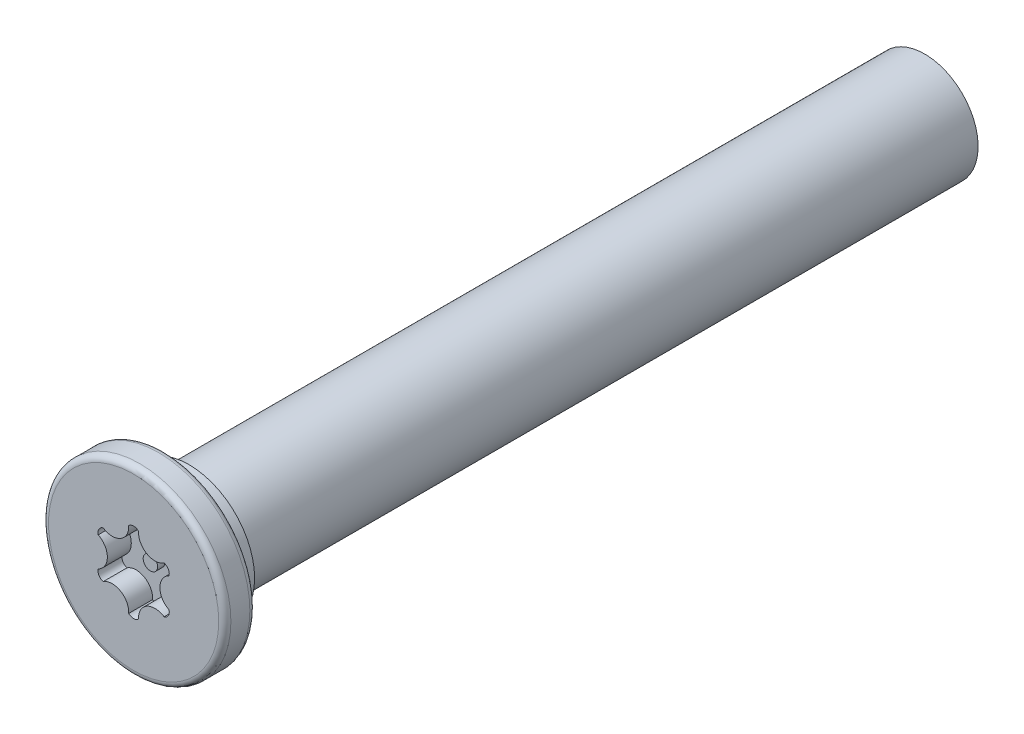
SolidWorks part; units mm, degrees
ref_plane "Front Plane" through (0, 0, 0) normal (0, 0, 1) x (1, 0, 0)
ref_plane "Top Plane" through (0, 0, 0) normal (0, 1, 0) x (1, 0, 0)
ref_plane "Right Plane" through (0, 0, 0) normal (1, 0, 0) x (0, 0, -1)
sketch "Sketch2" plane through (0, 0, 0) normal (1, 0, 0) x (0, 0, -1)
  line L1 (0, 0) -> (1.3, 0)
  line L2 (0, 0) -> (0, 3.81)
  line L3 (0, 3.81) -> (1.3, 3.81)
  line L4 (1.3, 0) -> (1.3, 3.81)
  line L5 (1.3, 0) -> (14, 0)
  line L6 (1.3, 0) -> (1.3, 2.23)
  line L7 (1.3, 2.23) -> (14, 2.23)
  line L8 (14, 0) -> (14, 2.23)
  dimension "D1" = 3.81
  dimension "D2" = 1.3
  dimension "D3" = 12.7
  dimension "D4" = 2.23
revolve "Revolve1" add sketch "Sketch2" angle 360 about L5
sketch "Sketch3" plane through (0, 0, 0) normal (0, 0, 1) x (1, 0, 0)
  line L0 (0, 1.3843) -> (0, 0)
  line L3 (1.1845, -1.0048) -> (2.4257, -1.0048)
  line L4 (0, 1.675) -> (0, 1.6727)
  line L5 (0, 1.675) -> (0, 1.6727)
  line L6 (0, 1.6727) -> (0, 1.675)
  line L8 (1.0407, 1.8026) -> (1.1012, 1.9073)
  line L9 (1.3857, 1.205) -> (2.5818, 1.205)
  line L10 (0, 0) -> (0.8375, 1.4506)
  line L11 (0, 0) -> (2.5818, 0)
  line L14 (2.5818, 0) -> (2.5818, 1.205)
  line L15 (1.3857, 1.205) -> (-0.1691, 1.205)
  circle A0 centre (0, 0) radius 1.675
  arc A7 (1.1845, -1.0048) -> (1.0345, -1.0748) centre (0.8546, -0.4934) cw
  arc A16 (-0.2051, 1.5894) -> (0.2051, 1.5894) centre (0, 1.3843) cw
  arc A18 (0.2051, 1.5894) -> (1.2739, 0.9723) centre (0.8938, 1.5482) ccw
  arc A19 (1.479, 0.6171) -> (1.479, -0.6171) centre (1.7877, 0) ccw
  arc A20 (1.2739, 0.9723) -> (1.479, 0.6171) centre (1.1988, 0.6922) cw
  arc A21 (1.2739, -0.9723) -> (0.2051, -1.5894) centre (0.8938, -1.5482) ccw
  arc A22 (1.479, -0.6171) -> (1.2739, -0.9723) centre (1.1988, -0.6922) cw
  arc A23 (-0.2051, -1.5894) -> (-1.2739, -0.9723) centre (-0.8938, -1.5482) ccw
  arc A24 (0.2051, -1.5894) -> (-0.2051, -1.5894) centre (0, -1.3843) cw
  arc A25 (-1.479, -0.6171) -> (-1.479, 0.6171) centre (-1.7877, 0) ccw
  arc A26 (-1.2739, -0.9723) -> (-1.479, -0.6171) centre (-1.1988, -0.6922) cw
  arc A27 (-1.2739, 0.9723) -> (-0.2051, 1.5894) centre (-0.8938, 1.5482) ccw
  arc A28 (-1.479, 0.6171) -> (-1.2739, 0.9723) centre (-1.1988, 0.6922) cw
  point P38 (0, 0)
  point P52 (0, 0)
  dimension "D1" = 3.35
  dimension "D4" = 1.205
  dimension "D2" = 6
  dimension "D5" = 60
extrude "Cut-Extrude3" cut sketch "Sketch3" against normal blind 1
fillet "Fillet12" radius 0.254 2 edges at (3.81, 0, 0) (3.81, 0, -1.3)
sketch "Sketch7" plane through (0, 0, -14) normal (0, 0, -1) x (-1, 0, 0)
  circle A0 centre (0, 0) radius 2.23
  dimension "D1" = 4.46
extrude "Cut-Extrude6" cut sketch "Sketch7" against normal blind 12.7
sketch "Sketch11" plane through (0, 0, -1.3) normal (0, 0, -1) x (-1, 0, 0)
  circle A0 centre (0, 0) radius 2.23
  circle A1 centre (0, 0) radius 2.738
extrude "Boss-Extrude1" add sketch "Sketch11" along normal blind 1.016
sketch "Sketch12" plane through (0, 0, -1.3) normal (0, 0, -1) x (-1, 0, 0)
  circle A0 centre (0, 0) radius 2.23
extrude "Boss-Extrude2" add sketch "Sketch12" along normal blind 12.7
sketch "Sketch14" plane through (0, 0, -1) normal (0, 0, 1) x (1, 0, 0)
  circle A0 centre (0, 0) radius 0.3
extrude "Boss-Extrude4" add sketch "Sketch14" along normal blind 0.3
sketch "Sketch15" plane through (0, 0, -14) normal (0, 0, -1) x (-1, 0, 0)
  circle A0 centre (0, 0) radius 2.23
extrude "Cut-Extrude7" cut sketch "Sketch15" against normal blind 12.7
sketch "Sketch16" plane through (0, 0, -1.3) normal (0, 0, -1) x (-1, 0, 0)
  circle A0 centre (0, 0) radius 2.23
extrude "Boss-Extrude5" add sketch "Sketch16" along normal blind 31.75
